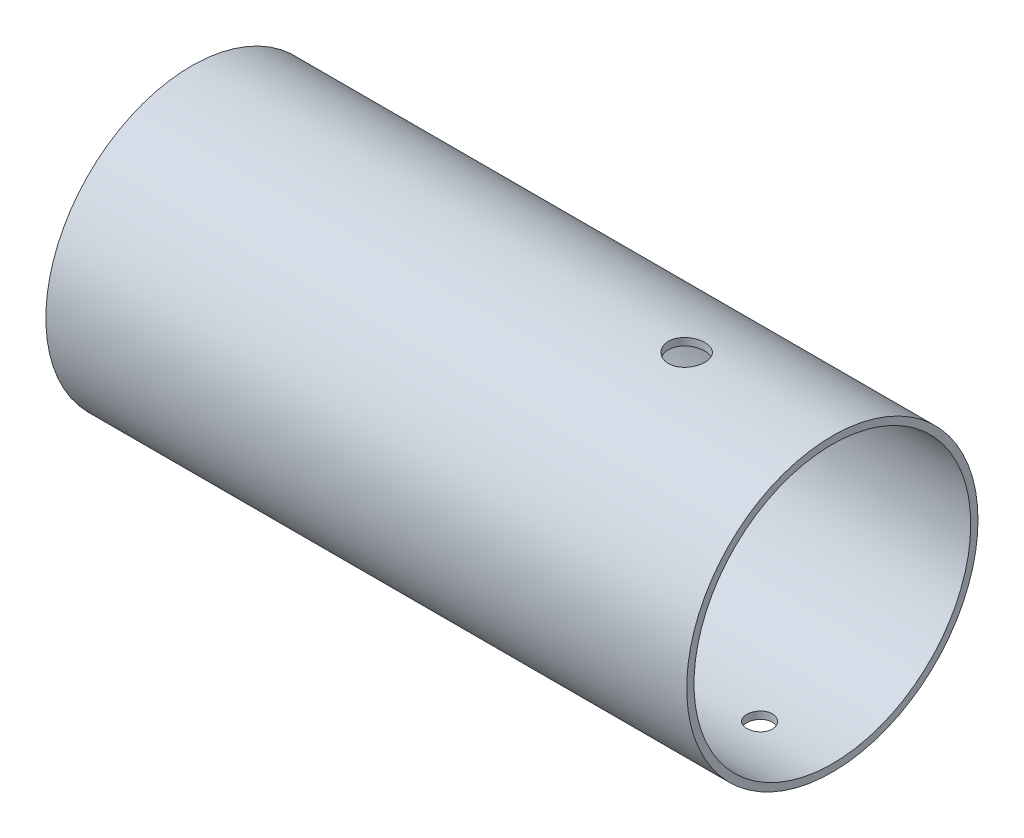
SolidWorks part; units mm, degrees
ref_plane "Front" through (0, 0, 0) normal (0, 0, 1) x (1, 0, 0)
ref_plane "Top" through (0, 0, 0) normal (0, 1, 0) x (1, 0, 0)
ref_plane "Right" through (0, 0, 0) normal (1, 0, 0) x (0, 0, -1)
sketch "Sketch1" plane through (0, 0, 0) normal (1, 0, 0) x (0, 0, -1)
  circle A0 centre (0, 0) radius 20
  circle A1 centre (0, 0) radius 19
extrude "Extrude1" add sketch "Sketch1" along normal blind 88
sketch "Sketch2" plane through (0, 0, 0) normal (0, 1, 0) x (1, 0, 0)
  circle A0 centre (10, 0) radius 1.75
  circle A1 centre (78, 0) radius 1.75
extrude "Cut-Extrude1" cut sketch "Sketch2" against normal blind 88
sketch "Sketch3" plane through (0, 0, 0) normal (0, 1, 0) x (1, 0, 0)
  circle A0 centre (68, 0) radius 2.5
extrude "Cut-Extrude2" cut sketch "Sketch3" along normal blind 88
